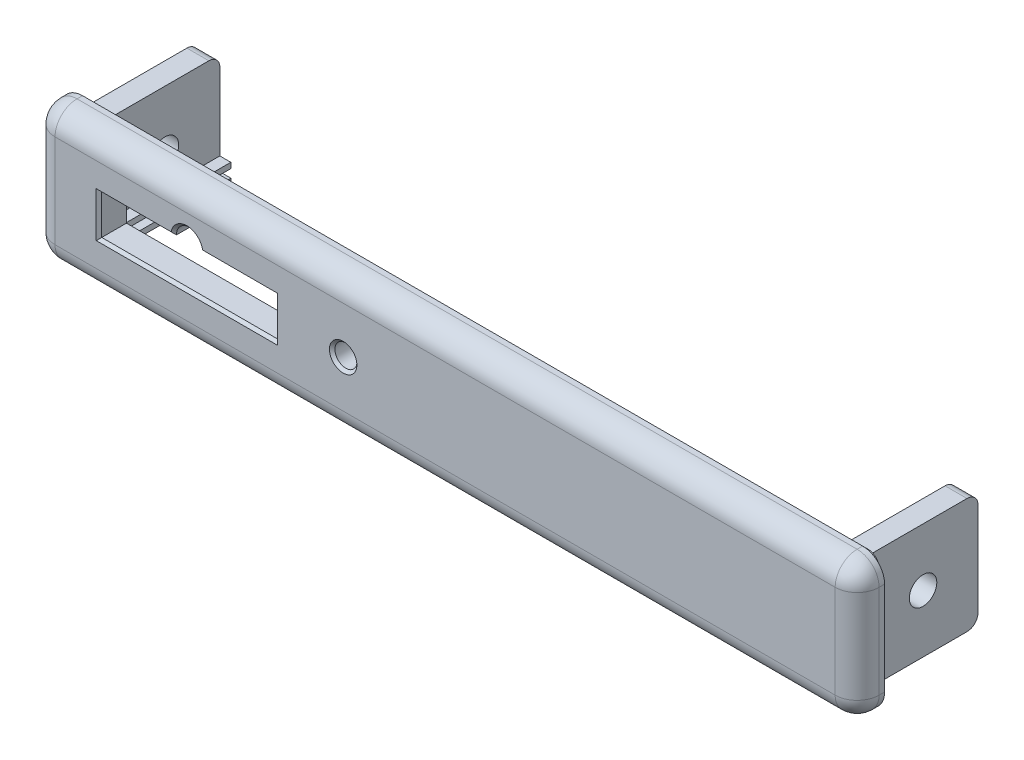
SolidWorks part; units mm, degrees
ref_plane "Front Plane" through (0, 0, 0) normal (0, 0, 1) x (1, 0, 0)
ref_plane "Top Plane" through (0, 0, 0) normal (0, 1, 0) x (1, 0, 0)
ref_plane "Right Plane" through (0, 0, 0) normal (1, 0, 0) x (0, 0, -1)
sketch "Skizze1" plane through (0, 0, 0) normal (0, 0, 1) x (1, 0, 0)
  line L0 (0, -55) -> (0, 55) construction
  line L1 (-37.5, 2.5) -> (37.5, 2.5)
  line L2 (-37.5, 2.5) -> (-37.5, -10)
  line L3 (-37.5, -10) -> (37.5, -10)
  line L4 (37.5, 2.5) -> (37.5, -10)
  line L5 (55, 0) -> (-55, 0) construction
  point P8 (-49.1749, 4.8059)
  dimension "D1" = 37.5
  dimension "D2" = 37.5
  dimension "D4" = 10
  dimension "D5" = 12.5
extrude "Linear austragen1" add sketch "Skizze1" along normal blind 3
sketch "Skizze3" plane through (37.5, 0, 0) normal (1, 0, 0) x (0, 0, -1)
  line L0 (0, -10) -> (0, 2.5) construction
  line L1 (0, 1.5) -> (10, 1.5)
  line L2 (0, 1.5) -> (0, -9)
  line L3 (0, -9) -> (10, -9)
  line L4 (10, 1.5) -> (10, -9)
  line L5 (-3, 2.5) -> (0, 2.5) construction
  line L6 (-3, -10) -> (0, -10) construction
  dimension "D1" = 1
  dimension "D2" = 1
  dimension "D3" = 10
extrude "Linear austragen2" add sketch "Skizze3" against normal blind 4
sketch "Skizze4" plane through (-37.5, 0, 0) normal (-1, 0, 0) x (0, 0, 1)
  line L0 (0, 2.5) -> (0, -10) construction
  line L1 (0, 1.5) -> (-10, 1.5)
  line L2 (0, 1.5) -> (0, -9)
  line L3 (0, -9) -> (-10, -9)
  line L4 (-10, 1.5) -> (-10, -9)
  line L5 (3, 2.5) -> (0, 2.5) construction
  line L6 (3, -10) -> (0, -10) construction
  dimension "D1" = 1
  dimension "D2" = 1
  dimension "D3" = 10
extrude "Linear austragen3" add sketch "Skizze4" against normal blind 4
fillet "Verrundung1" radius 2 8 edges at (0, 2.5, 3) (37.5, -3.75, 3) (0, -10, 3) (-37.5, -3.75, 3) (-37.5, -10, 1.5) (-37.5, 2.5, 1.5) (37.5, -10, 1.5) (37.5, 2.5, 1.5)
sketch "Skizze6" plane through (0, 0, -10) normal (0, 0, -1) x (-1, 0, 0)
  line L1 (-40.5, 3) -> (-35.5, 3)
  line L2 (-40.5, 3) -> (-40.5, -9)
  line L3 (-40.5, -9) -> (-35.5, -9)
  line L4 (-35.5, 3) -> (-35.5, -9)
  line L5 (-37.5, -8) -> (-37.5, 0.5) construction
  line L7 (-33.5, 1.5) -> (-37.2321, 1.5) construction
  dimension "D1" = 1.5
  dimension "D2" = 5
  dimension "D3" = 2
  dimension "D4" = 12
extrude "Schnitt-Linear austragen1" cut sketch "Skizze6" against normal up to surface (10 mm away)
sketch "Skizze7" plane through (0, 0, -10) normal (0, 0, -1) x (-1, 0, 0)
  line L1 (35.5, 9.3634) -> (40.5, 9.3634)
  line L2 (35.5, 9.3634) -> (35.5, -9.8152)
  line L3 (35.5, -9.8152) -> (40.5, -9.8152)
  line L4 (40.5, 9.3634) -> (40.5, -9.8152)
  line L5 (37.5, 0.5) -> (37.5, -8) construction
  dimension "D1" = 5
  dimension "D2" = 2
extrude "Schnitt-Linear austragen2" cut sketch "Skizze7" against normal up to surface (10 mm away)
sketch "Skizze8" plane through (35.5, 0, 0) normal (1, 0, 0) x (0, 0, -1)
  line L0 (0, -9) -> (0, 1.5) construction
  line L2 (0, -9) -> (10, -9) construction
  line L5 (10, 1.5) -> (0, 1.5) construction
  line L6 (0, -9) -> (10, -9) construction
  circle A0 centre (5, -3.75) radius 1.25
  dimension "D1" = 2.5
  dimension "D2" = 5
  dimension "D3" = 5.25
  dimension "D4" = 5.25
  dimension "D5" = 5.25
extrude "Schnitt-Linear austragen3" cut sketch "Skizze8" against normal through all
sketch "Skizze11" plane through (0, 0, -10) normal (0, 0, -1) x (-1, 0, 0)
  line L0 (-33.5, -9) -> (-33.5, 1.5) construction
  line L1 (-33.5, -6.5) -> (33.5, -6.5)
  line L2 (-33.5, -6.5) -> (-33.5, -8.25)
  line L3 (-33.5, -8.25) -> (33.5, -8.25)
  line L4 (33.5, -6.5) -> (33.5, -8.25)
  line L5 (33.5, 1.5) -> (33.5, -9) construction
  line L6 (-33.5, -9) -> (-35.5, -9) construction
  dimension "D1" = 0.75
  dimension "D2" = 1.75
extrude "Linear austragen4" add sketch "Skizze11" against normal up to surface (10 mm away)
sketch "Skizze13" plane through (0, 0, -10) normal (0, 0, -1) x (-1, 0, 0)
  line L0 (-33.5, -6.5) -> (-33.5, 1.5) construction
  line L1 (-33.5, -7) -> (33.5, -7)
  line L2 (-33.5, -7) -> (-33.5, -7.75)
  line L3 (-33.5, -7.75) -> (33.5, -7.75)
  line L4 (33.5, -7) -> (33.5, -7.75)
  line L5 (33.5, 1.5) -> (33.5, -6.5) construction
  line L6 (-33.5, -8.25) -> (33.5, -8.25) construction
  line L7 (-33.5, -8.25) -> (33.5, -8.25) construction
  dimension "D1" = 0.5
  dimension "D2" = 1.25
extrude "Schnitt-Linear austragen4" cut sketch "Skizze13" against normal up to surface (10 mm away)
sketch "Skizze14" plane through (0, 0, -10) normal (0, 0, -1) x (-1, 0, 0)
  line L1 (-32.5, -2.25) -> (32.5, -1)
  line L2 (-32.5, -2.25) -> (-32.5, -10.25)
  line L3 (-32.5, -10.25) -> (32.5, -10.25)
  line L4 (32.5, -1) -> (32.5, -10.25)
  line L8 (-33.5, -6.5) -> (-33.5, 1.5) construction
  line L9 (33.5, 1.5) -> (33.5, -6.5) construction
  line L10 (-33.5, -8.25) -> (33.5, -8.25) construction
  dimension "D1" = 1
  dimension "D2" = 1
  dimension "D3" = 2
  dimension "D4" = 8
extrude "Schnitt-Linear austragen5" cut sketch "Skizze14" against normal up to surface (10 mm away)
fillet "Verrundung2" radius 1 1 edges at (34.5, 1.5, -10)
fillet "Verrundung3" radius 1 3 edges at (33, -8.25, -10) (33.5, -8.625, -10) (34.5, -9, -10)
fillet "Verrundung4" radius 1 1 edges at (-34.5, 1.5, -10)
fillet "Verrundung5" radius 1 3 edges at (-33.5, -8.625, -10) (-33, -8.25, -10) (-34.5, -9, -10)
sketch "Skizze15" plane through (0, 0, 3) normal (0, 0, 1) x (1, 0, 0)
  line L0 (-35.5, 2.5) -> (35.5, 2.5) construction
  line L1 (-31.5, -1.95) -> (-15.5, -1.95)
  line L2 (-31.5, -1.95) -> (-31.5, -5.55)
  line L3 (-31.5, -5.55) -> (-15.5, -5.55)
  line L4 (-15.5, -1.95) -> (-15.5, -5.55)
  line L5 (-37.5, -8) -> (-37.5, 0.5) construction
  line L6 (-35.5, -8) -> (35.5, -8) construction
  line L7 (35.5, 0.5) -> (-35.5, 0.5) construction
  dimension "D1" = 4.45
  dimension "D2" = 3.6
  dimension "D3" = 16
  dimension "D4" = 6
  dimension "D5" = 2.45
  dimension "D6" = 2.45
extrude "Schnitt-Linear austragen6" cut sketch "Skizze15" against normal through all
sketch "Skizze16" plane through (0, 0, 3) normal (0, 0, 1) x (1, 0, 0)
  line L0 (-31.5, -5.55) -> (-15.5, -5.55) construction
  line L1 (-15.5, -1.95) -> (-31.5, -1.95) construction
  circle A0 centre (-9.2778, -3.75) radius 1
  dimension "D1" = 2
  dimension "D2" = 1.8
  dimension "D3" = 1.8
extrude "Schnitt-Linear austragen7" cut sketch "Skizze16" against normal through all
chamfer "Fase1" distance 0.25 angle 45 1 edges at (-8.2778, -3.75, 3)
sketch "Skizze17" plane through (0, 0, 3) normal (0, 0, 1) x (1, 0, 0)
  line L0 (-15.5, -1.95) -> (-31.5, -1.95) construction
  line L1 (-31.5, -1.95) -> (-31.5, -5.55) construction
  line L2 (-15.5, -5.55) -> (-15.5, -1.95) construction
  arc A0 (-22.3, -1.95) -> (-24.7, -1.95) centre (-23.5, -1.95) ccw
  point P7 (-15.5, -3.75)
  dimension "D3" = 1.2
  dimension "D1" = 8
  dimension "D2" = 8
extrude "Schnitt-Linear austragen8" cut sketch "Skizze17" against normal through all and the other way through all
chamfer "Fase2" distance 0.25 angle 45 6 edges at (-23.5, -0.75, 3) (-28.1, -1.95, 3) (-31.5, -3.75, 3) (-23.5, -5.55, 3) (-15.5, -3.75, 3) (-18.9, -1.95, 3)
sketch "Skizze18" plane through (0, 0, 0) normal (0, 0, -1) x (-1, 0, 0)
  line L0 (-37.5, -8) -> (-37.5, 0.5) construction
  line L1 (-38.5, 3.5) -> (38.5, 3.5)
  line L2 (-38.5, 3.5) -> (-38.5, -11)
  line L4 (38.5, 3.5) -> (38.5, -11)
  line L5 (-35.5, 2) -> (35.5, 2)
  line L6 (-36.5, 1) -> (-36.5, -8.5)
  line L7 (-38.5, -11) -> (38.5, -11)
  line L8 (36.5, 1) -> (36.5, -8.5)
  line L9 (-35.5, 2.5) -> (35.5, 2.5) construction
  line L10 (35.5, -10) -> (-35.5, -10) construction
  line L11 (37.5, 0.5) -> (37.5, -8) construction
  line L12 (-35.5, -9.5) -> (35.5, -9.5)
  arc A0 (-36.5, -8.5) -> (-35.5, -9.5) centre (-35.5, -8.5) ccw
  arc A1 (-35.5, 2) -> (-36.5, 1) centre (-35.5, 1) ccw
  arc A2 (35.5, -9.5) -> (36.5, -8.5) centre (35.5, -8.5) ccw
  arc A3 (35.5, 2) -> (36.5, 1) centre (35.5, 1) cw
  dimension "D8" = 1
  dimension "D1" = 1
  dimension "D2" = 1
  dimension "D3" = 0.5
  dimension "D5" = 1
  dimension "D6" = 1
  dimension "D7" = 1
  dimension "D9" = 0.5
extrude "Schnitt-Linear austragen9" cut sketch "Skizze18" against normal blind 0.5
sketch "Skizze19" plane through (0, 0, 0) normal (0, 0, -1) x (-1, 0, 0)
  line L0 (15.5, -5.55) -> (15.5, -1.95) construction
  line L1 (15.5, -0.05) -> (31.5, -0.05)
  line L2 (14.5, -1.05) -> (14.5, -5.55)
  line L3 (15.5, -6.55) -> (31.5, -6.55)
  line L4 (32.5, -1.05) -> (32.5, -5.55)
  line L5 (31.5, -1.95) -> (31.5, -5.55) construction
  line L6 (15.5, -1.95) -> (22.3, -1.95) construction
  line L7 (31.5, -5.55) -> (15.5, -5.55) construction
  arc A0 (14.5, -1.05) -> (15.5, -0.05) centre (15.5, -1.05) cw
  arc A1 (15.5, -6.55) -> (14.5, -5.55) centre (15.5, -5.55) cw
  arc A2 (32.5, -5.55) -> (31.5, -6.55) centre (31.5, -5.55) cw
  arc A3 (31.5, -0.05) -> (32.5, -1.05) centre (31.5, -1.05) cw
  dimension "D5" = 1
  dimension "D1" = 1
  dimension "D2" = 1
  dimension "D3" = 1.9
  dimension "D4" = 1
extrude "Schnitt-Linear austragen10" cut sketch "Skizze19" against normal blind 0.5
